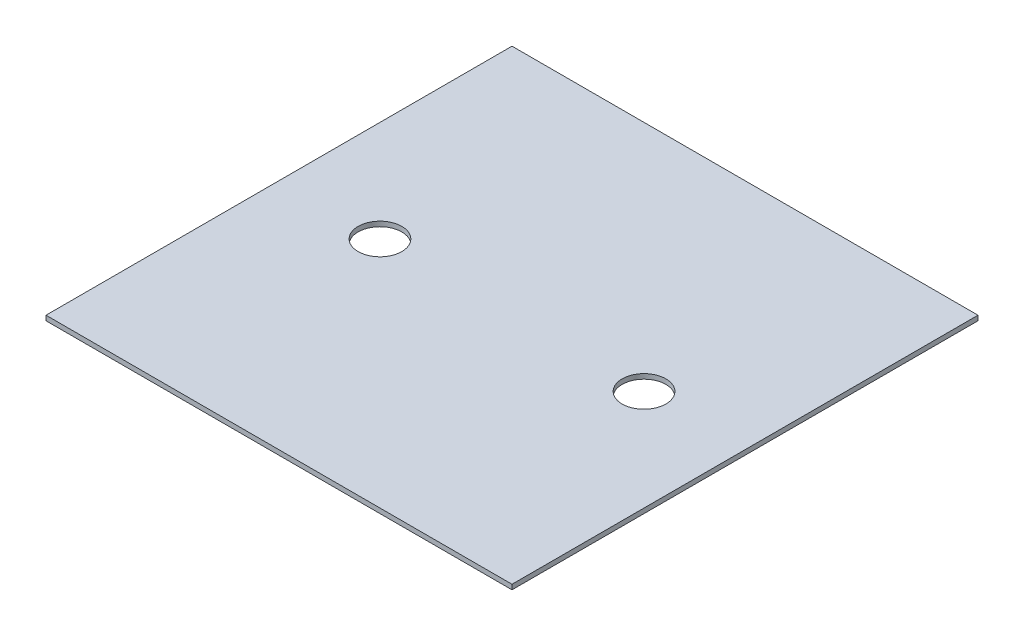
SolidWorks part; units mm, degrees
ref_plane "Front Plane" through (0, 0, 0) normal (0, 0, 1) x (1, 0, 0)
ref_plane "Top Plane" through (0, 0, 0) normal (0, 1, 0) x (1, 0, 0)
ref_plane "Right Plane" through (0, 0, 0) normal (1, 0, 0) x (0, 0, -1)
sketch "Sketch1" plane through (0, 0, 0) normal (0, 1, 0) x (1, 0, 0)
  line L1 (-76.2, 76.2) -> (76.2, 76.2)
  line L2 (-76.2, 76.2) -> (-76.2, -76.2)
  line L3 (-76.2, -76.2) -> (76.2, -76.2)
  line L4 (76.2, 76.2) -> (76.2, -76.2)
  point P4 (0, 76.2)
  point P6 (-76.2, 0)
  dimension "D1" = 152.4
  dimension "D2" = 152.4
extrude "Boss-Extrude1" add sketch "Sketch1" along normal blind 1.5875
sketch "Sketch2" plane through (0, 0, 0) normal (0, 1, 0) x (1, 0, 0)
  circle A0 centre (-43.18, 0) radius 7.1437
  circle A1 centre (43.18, 0) radius 7.1437
  dimension "D3" = 14.2875
  dimension "D4" = 14.2875
  dimension "D1" = 43.18
  dimension "D2" = 43.18
extrude "Cut-Extrude1" cut sketch "Sketch2" along normal blind 25.4
